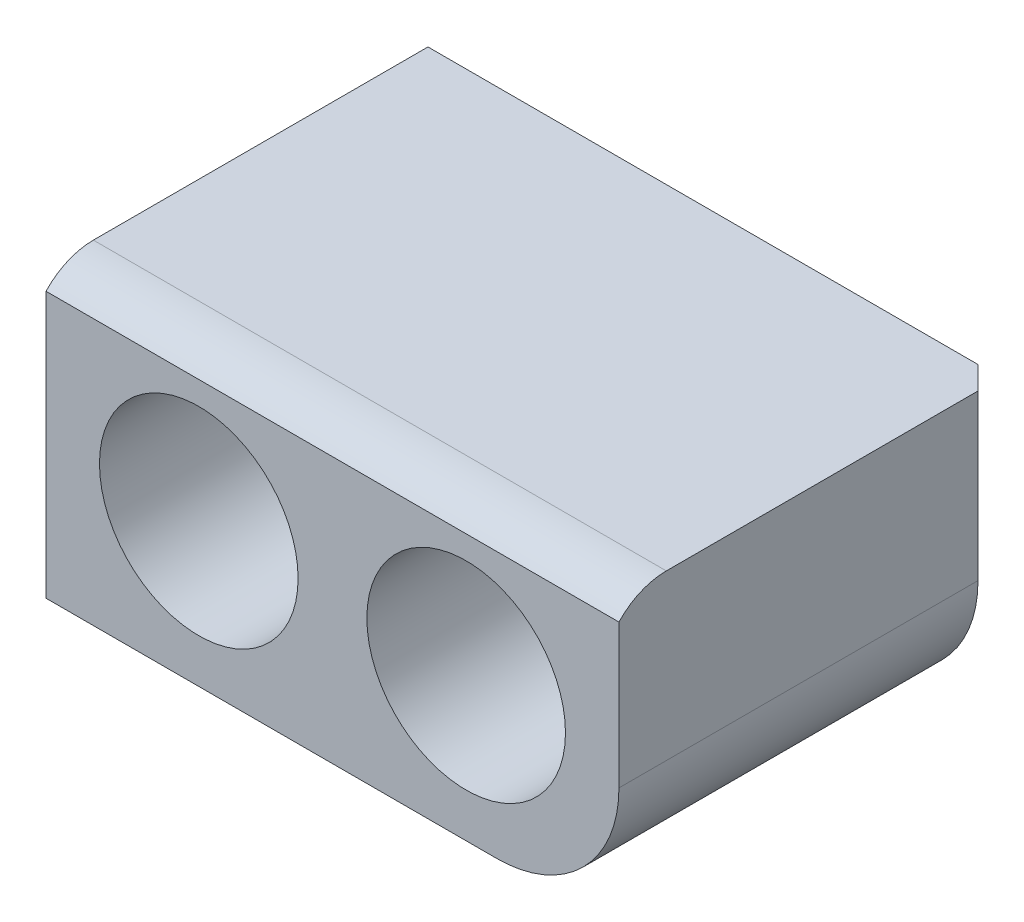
SolidWorks part; units mm, degrees
ref_plane "Front Plane" through (0, 0, 0) normal (0, 0, 1) x (1, 0, 0)
ref_plane "Top Plane" through (0, 0, 0) normal (0, 1, 0) x (1, 0, 0)
ref_plane "Right Plane" through (0, 0, 0) normal (1, 0, 0) x (0, 0, -1)
sketch "Sketch3" plane through (0, 0, 0) normal (0, 0, 1) x (1, 0, 0)
  line L0 (0, -5.2388) -> (0, 5.2388) construction
  line L1 (0, 0) -> (19.05, 0)
  line L2 (0, 0) -> (0, -9.525)
  line L3 (0, -9.525) -> (19.05, -9.525)
  line L4 (19.05, 0) -> (19.05, -9.525)
  dimension "D1" = 9.525
  dimension "D2" = 19.05
extrude "Extrude1" add sketch "Sketch3" against normal blind 12.7
fillet "Fillet1" radius 4.064 1 edges at (19.05, -9.525, -6.35)
hole_wizard "#6 CBORE" positions "Sketch5" profile "Sketch4" counterbore size "#10" standard "ANSI Inch"
sketch "Sketch5" plane through (0, 0, 0) normal (0, 0, 1) x (1, 0, 0)
  line L0 (-1.269, -4.7625) -> (49998.731, -4.7625) construction
  line L1 (19.05, 0) -> (0, 0) construction
  line L2 (0, -9.525) -> (14.986, -9.525) construction
  line L3 (0, 0) -> (0, -9.525) construction
  point P0 (5.08, -4.7625)
  point P1 (13.97, -4.7625)
  dimension "D1" = 5.08
  dimension "D2" = 13.97
sketch "Sketch4" plane through (5.08, -4.7625, 0) normal (1, 0, 0) x (0, -1, 0)
  line L0 (0, 0) -> (0, 12.7)
  line L1 (0, 12.7) -> (2.159, 12.7)
  line L3 (2.159, 12.7) -> (2.159, 4.826)
  line L4 (2.159, 4.826) -> (3.302, 4.826)
  line L5 (3.302, 4.826) -> (3.302, 0)
  line L7 (3.302, 0) -> (0, 0)
  line L11 (0, -6.35) -> (0, 107.95) construction
  dimension "Thru Hole Dia." = 4.318
  dimension "Thru Hole Depth" = 12.7
  dimension "C'Bore Dia." = 6.604
  dimension "C'Bore Depth" = 4.826
sketch "Sketch6" plane through (0, 0, 0) normal (-1, 0, 0) x (0, 0, 1)
  line L0 (0, -0.6851) -> (0.9652, -0.6851)
  line L1 (-1.5748, 0) -> (-1.5748, 0.5849)
  line L3 (-12.7, 0) -> (0, 0) construction
  line L4 (0.9652, -0.6851) -> (0.9652, 0.5849)
  line L5 (0.9652, 0.5849) -> (-1.5748, 0.5849)
  arc A0 (-1.5748, 0) -> (0, -0.6851) centre (-1.5748, -2.1525) cw
  dimension "D4" = 1.27
  dimension "D5" = 2.54
extrude "Cut-Extrude1" cut sketch "Sketch6" against normal through all
chamfer "Chamfer1" distance 0.762 angle 45 3 edges at (7.493, -9.525, -12.7) (17.8597, -8.3347, -12.7) (19.05, -2.7305, -12.7)
